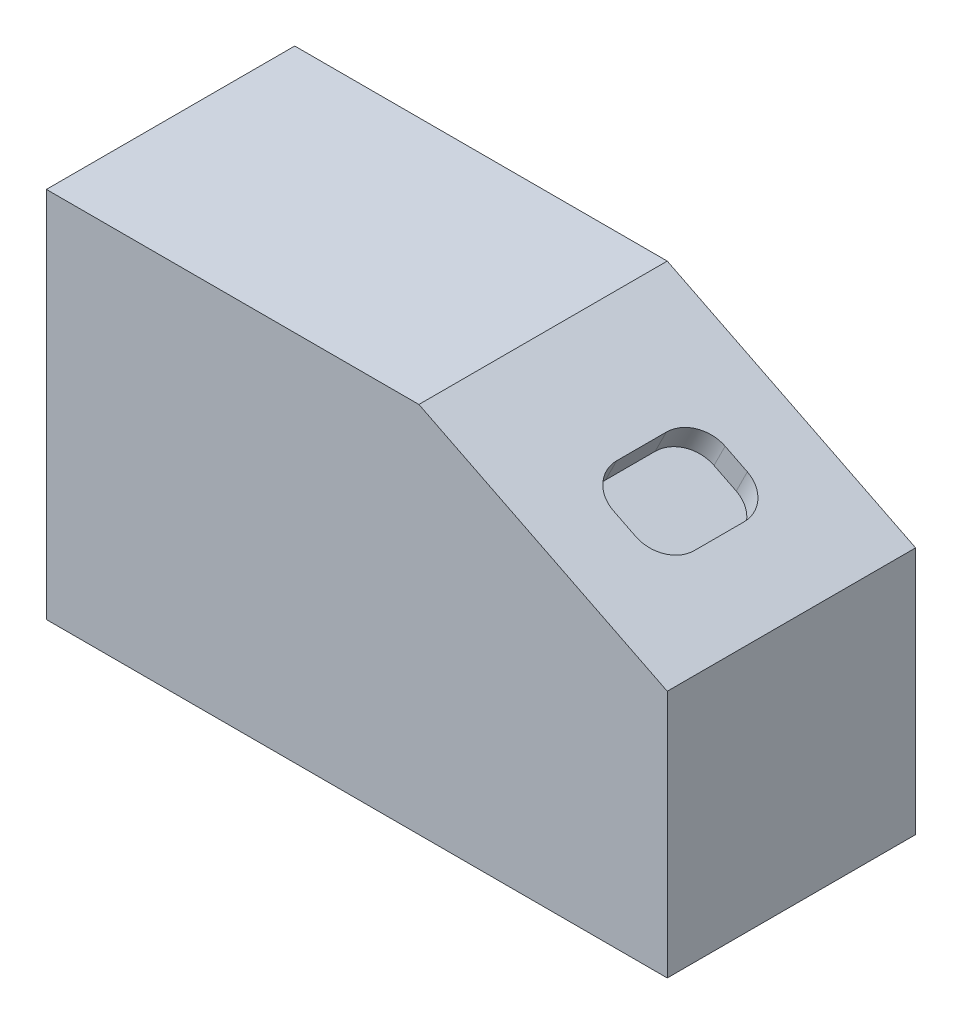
SolidWorks part; units mm, degrees
ref_plane "正面" through (0, 0, 0) normal (0, 0, 1) x (1, 0, 0)
ref_plane "平面" through (0, 0, 0) normal (0, 1, 0) x (1, 0, 0)
ref_plane "右側面" through (0, 0, 0) normal (1, 0, 0) x (0, 0, -1)
sketch "ｽｹｯﾁ1" plane through (0, 0, 0) normal (0, 0, 1) x (1, 0, 0)
  line L1 (0, 0) -> (100, 0)
  line L2 (0, 0) -> (0, 60)
  line L3 (0, 60) -> (100, 60)
  line L4 (100, 0) -> (100, 60)
  dimension "D1" = 100
  dimension "D2" = 60
extrude "ﾎﾞｽ - 押し出し1" add sketch "ｽｹｯﾁ1" against normal blind 40
sketch "ｽｹｯﾁ2" plane through (0, 0, 0) normal (0, 0, 1) x (1, 0, 0)
  line L0 (100, 60) -> (100, 40)
  line L1 (100, 0) -> (100, 60) construction
  line L2 (100, 40) -> (60, 60)
  line L3 (100, 60) -> (0, 60) construction
  line L4 (60, 60) -> (100, 60)
  dimension "D1" = 20
  dimension "D2" = 40
extrude "ｶｯﾄ - 押し出し1" cut sketch "ｽｹｯﾁ2" against normal through all
sketch "ｽｹｯﾁ3" plane through (36, 72, 0) normal (0.4472, 0.8944, 0) x (0.8944, -0.4472, 0)
  line L0 (51.5542, 20) -> (71.5542, 20) construction
  line L1 (44.5542, 11) -> (58.5542, 11)
  line L2 (44.5542, 11) -> (44.5542, 29)
  line L3 (44.5542, 29) -> (58.5542, 29)
  line L4 (58.5542, 11) -> (58.5542, 29)
  line L5 (44.5542, 11) -> (58.5542, 29) construction
  line L6 (44.5542, 29) -> (58.5542, 11) construction
  line L7 (71.5542, 40) -> (71.5542, 0) construction
  point P0 (51.5542, 20)
  dimension "D1" = 20
  dimension "D2" = 14
  dimension "D3" = 18
extrude "ｶｯﾄ - 押し出し2" cut sketch "ｽｹｯﾁ3" against normal blind 4
fillet "ﾌｨﾚｯﾄ1" radius 5 4 edges at (74.956, 50.2859, -11) (87.478, 44.0249, -11) (87.478, 44.0249, -29) (74.956, 50.2859, -29)
